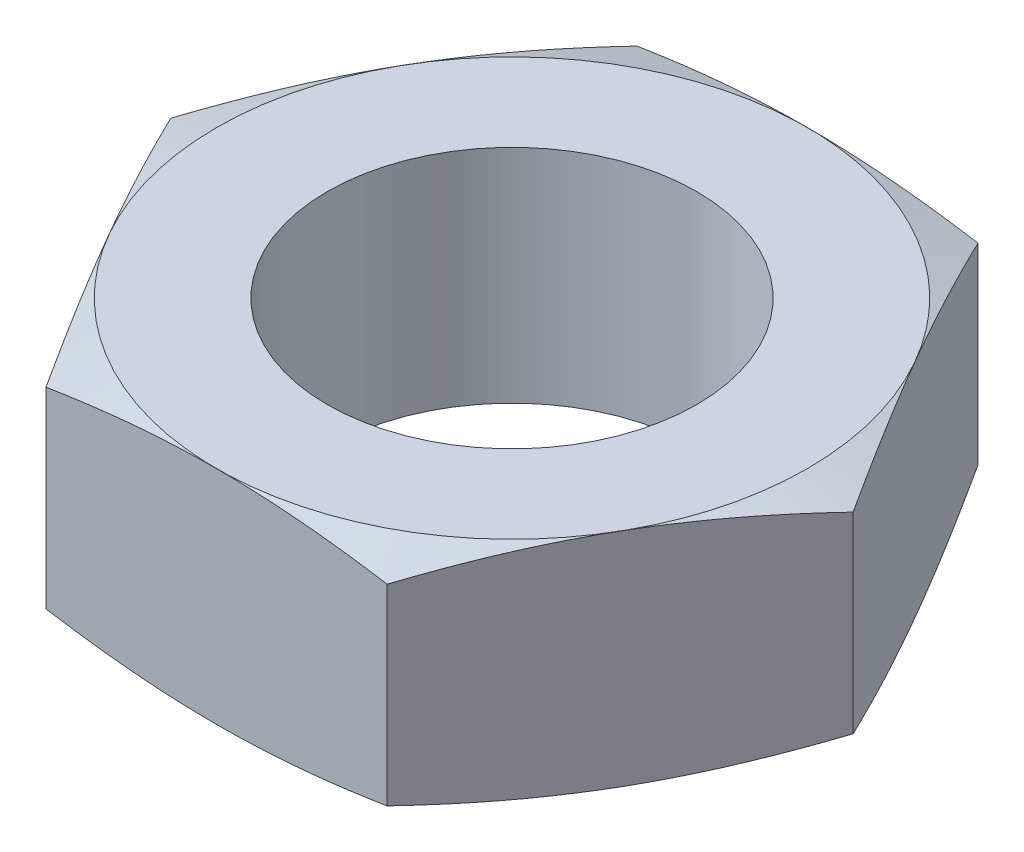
SolidWorks part; units mm, degrees
ref_plane "Front Plane" through (0, 0, 0) normal (0, 0, 1) x (1, 0, 0)
ref_plane "Top Plane" through (0, 0, 0) normal (0, 1, 0) x (1, 0, 0)
ref_plane "Right Plane" through (0, 0, 0) normal (1, 0, 0) x (0, 0, -1)
sketch "Sketch5" plane through (0, 0, 0) normal (0, 1, 0) x (1, 0, 0)
  line L1 (-7.3323, 0) -> (-3.6662, -6.35)
  line L2 (-3.6662, -6.35) -> (3.6662, -6.35)
  line L3 (3.6662, -6.35) -> (7.3323, 0)
  line L4 (7.3323, 0) -> (3.6662, 6.35)
  line L5 (3.6662, 6.35) -> (-3.6662, 6.35)
  line L6 (-3.6662, 6.35) -> (-7.3323, 0)
  circle A0 centre (0, 0) radius 6.35 construction
  circle A1 centre (0, 0) radius 3.9688
extrude "Extrude2" add sketch "Sketch5" along normal blind 4.7625
sketch "Sketch6" plane through (0, 0, 0) normal (0, 0, 1) x (1, 0, 0)
  line L0 (7.3323, 0) -> (7.3323, 0.3175)
  line L1 (7.3323, 4.7625) -> (7.3323, 0) construction
  line L2 (7.3323, 0) -> (6.3494, 0)
  line L3 (6.3494, 0) -> (7.3323, 0.3175)
  line L4 (0, 0) -> (0, 20.357) construction
  line L5 (7.3323, 4.7625) -> (7.3323, 4.445)
  line L6 (7.3323, 4.7625) -> (7.3323, 0) construction
  line L7 (7.3323, 4.445) -> (6.3494, 4.7625)
  line L8 (6.3494, 4.7625) -> (7.3323, 4.7625)
  dimension "D1" = 0.3175
  dimension "D2" = 0.983
  dimension "D3" = 0.983
  dimension "D4" = 0.3175
revolve "Cut-Revolve1" cut sketch "Sketch6" angle 360 about L4
